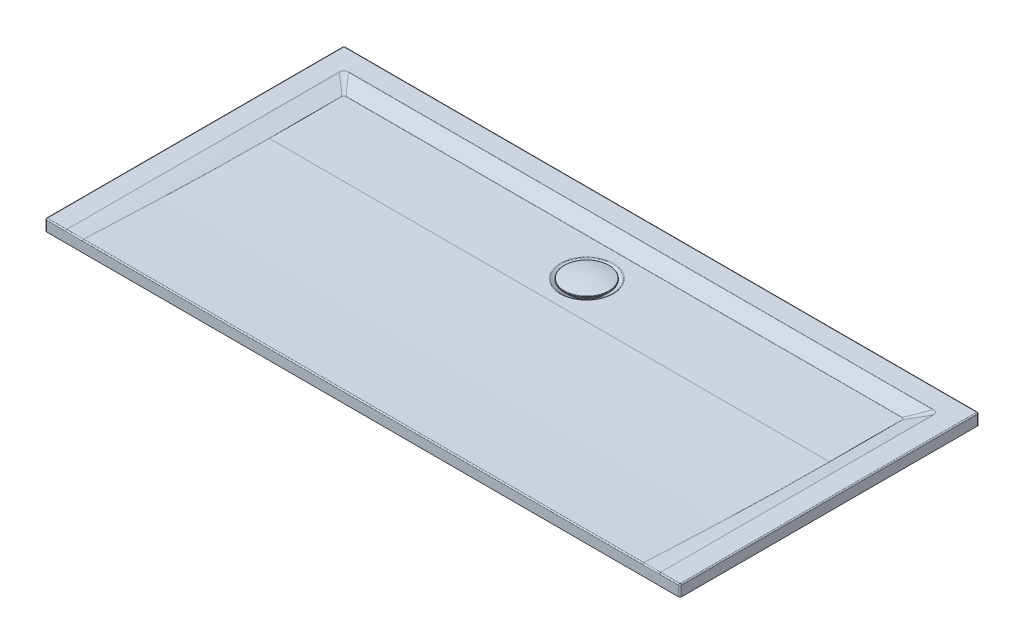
SolidWorks part; units mm, degrees
ref_plane "Płaszczyzna przednia" through (0, 0, 0) normal (0, 0, 1) x (1, 0, 0)
ref_plane "Płaszczyzna górna" through (0, 0, 0) normal (0, 1, 0) x (1, 0, 0)
ref_plane "Płaszczyzna prawa" through (0, 0, 0) normal (1, 0, 0) x (0, 0, -1)
sketch "Szkic1" plane through (0, 0, 0) normal (0, 1, 0) x (1, 0, 0)
  line L0 (0, 400) -> (0, -400) construction
  line L1 (-850, 400) -> (850, 400)
  line L2 (-850, 400) -> (-850, -400)
  line L3 (-850, -400) -> (850, -400)
  line L4 (850, 400) -> (850, -400)
  line L5 (-795, -400) -> (-795, 345)
  line L6 (-795, 345) -> (795, 345)
  line L7 (795, 345) -> (795, -400)
  line L8 (-750, -400) -> (-750, 300)
  line L9 (-750, 300) -> (750, 300)
  line L10 (750, 300) -> (750, -400)
  circle A0 centre (0, 200) radius 45
  circle A1 centre (0, 200) radius 70
  point P9 (0, 345)
  dimension "D6" = 90
  dimension "D7" = 140
  dimension "D1" = 1700
  dimension "D2" = 55
  dimension "D3" = 55
  dimension "D5" = 200
  dimension "D8" = 800
  dimension "D4" = 45
sketch "Szkic2" plane through (0, 0, 0) normal (0, 1, 0) x (1, 0, 0)
  line L0 (-850, -400) -> (850, -400) construction
  line L1 (850, 400) -> (850, -400) construction
  line L2 (795, 345) -> (795, -400) construction
  line L3 (-795, 345) -> (795, 345) construction
  line L4 (-850, 400) -> (850, 400) construction
  line L5 (-795, -400) -> (-795, 345) construction
  line L6 (-850, 400) -> (-850, -400) construction
  line L7 (-850, -400) -> (-795, -400)
  line L8 (850, 400) -> (850, -400)
  line L9 (795, 345) -> (795, -400)
  line L10 (-795, 345) -> (795, 345)
  line L11 (-850, 400) -> (850, 400)
  line L12 (-795, -400) -> (-795, 345)
  line L13 (-850, 400) -> (-850, -400)
  line L14 (795, -400) -> (850, -400)
surface "Powierzchnia-Płaszczyzna1" sketch "Szkic2"
ref_plane "Płaszczyzna1" through (0, -15, 0) normal (0, 1, 0) x (-1, 0, 0)
sketch "Szkic3" plane through (0, -15, 0) normal (0, 1, 0) x (-1, 0, 0)
  line L0 (750, -100) -> (-750, -100)
  line L1 (750, 400) -> (750, -300) construction
  line L2 (-750, -300) -> (-750, 400) construction
  line L3 (0, -100) -> (0, -300) construction
  line L4 (750, -300) -> (-750, -300) construction
  line L5 (-750, -300) -> (-750, -100)
  line L6 (750, -100) -> (750, -300)
  line L7 (750, -300) -> (-750, -300)
  circle A0 centre (0, -200) radius 70 construction
  circle A1 centre (0, -200) radius 70
  point P10 (0, -200)
surface "Powierzchnia-Płaszczyzna2" sketch "Szkic3"
sketch "Szkic4" plane through (0, 0, 0) normal (0, 1, 0) x (1, 0, 0)
  line L0 (750, -400) -> (-750, -400)
other "Granica-Powierzchnia1"
other "Granica-Powierzchnia2"
other "Granica-Powierzchnia3"
mirror "Lustro1" about plane through (0, 0, 0) normal (1, 0, 0)
sketch "Szkic5" plane through (0, 0, 0) normal (0, 1, 0) x (1, 0, 0)
  line L0 (850, 400) -> (850, -400) construction
  line L1 (-850, 400) -> (850, 400) construction
  line L2 (-850, 400) -> (-850, -400) construction
  line L3 (-850, -400) -> (850, -400) construction
  line L4 (850, 400) -> (850, -400)
  line L5 (-850, 400) -> (850, 400)
  line L6 (-850, 400) -> (-850, -400)
  line L7 (-850, -400) -> (850, -400)
surface "Powierzchnia-Wyciągnięcie1" sketch "Szkic5" parameters "D1"=30
sketch "Szkic7" plane through (0, 0, 0) normal (1, 0, 0) x (0, 0, -1)
  line L0 (200, 0) -> (200, -30) construction
  line L1 (400, -30) -> (-400, -30) construction
  line L2 (245, -30) -> (245, -28)
  line L3 (245, -28) -> (249, -28)
  line L6 (249, -28) -> (270, -15)
  dimension "D1" = 90
  dimension "D2" = 2
  dimension "D3" = 98
surface "Powierzchnia-Obrót wokół linii środkowej1" sketch "Szkic7" parameters "D1"=360
surface "Powierzchnia-Płaszczyzna3"
surface "Powierzchnia-Połącz1"
fillet "Zaokrąglenie1" radius 4 6 edges at (0, -28, -249) (0, -15, -130) (850, -15, 400) (850, -15, -400) (-850, -15, -400) (-850, -15, 400)
fillet "Zmienne zaokrąglenie1" radius 40 2 edges at (772.5, -7.5, -322.5)
fillet "Zaokrąglenie3" radius 3 12 edges
fillet "Zaokrąglenie4" radius 3 12 edges at (-848.8284, 0, -398.8284) (0, 0, -400) (848.8284, 0, -398.8284) (850, 0, 0) (848.8284, 0, 398.8284) (820.5, 0, 400) (-820.5, 0, 400) (-848.8284, 0, 398.8284) (-850, 0, 0)
sketch "Szkic8" plane through (0, 0, 0) normal (1, 0, 0) x (0, 0, -1)
  line L0 (200, 0) -> (200, -30) construction
  line L1 (200, -5.6601) -> (179.8469, -5.6601) construction
  line L2 (260, -14.7573) -> (260, -17)
  line L3 (260, -17) -> (200, -17)
  line L4 (200, -17) -> (200, -5.6601)
  line L5 (200, -5.6601) -> (199.9922, 95.6514)
  arc A0 (200, -5.6601) -> (259.2694, -13.7943) centre (200, -225.6601) cw
  arc A1 (259.2694, -13.7943) -> (260, -14.7573) centre (259, -14.7573) cw
  point P11 (260, -14)
  dimension "D1" = 220
  dimension "D4" = 1
  dimension "D2" = 60
  dimension "D3" = 3
  dimension "D5" = 13
revolve "Obrót wokół linii środkowej1" add sketch "Szkic8" angle 360 about L4
